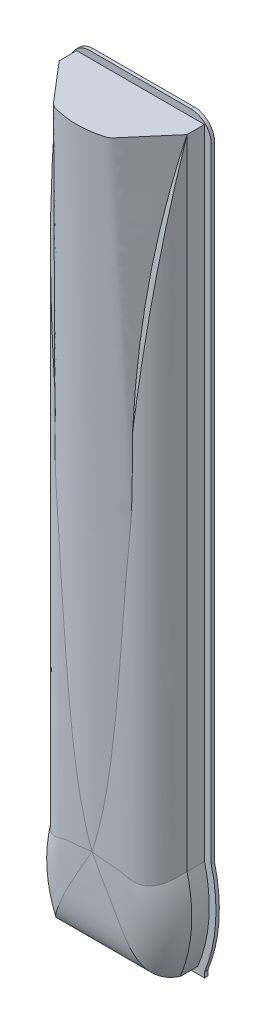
SolidWorks part; units mm, degrees
ref_plane "Ebene vorne" through (0, 0, 0) normal (0, 0, 1) x (1, 0, 0)
ref_plane "Ebene oben" through (0, 0, 0) normal (0, 1, 0) x (1, 0, 0)
ref_plane "Ebene rechts" through (0, 0, 0) normal (1, 0, 0) x (0, 0, -1)
sketch "Oben Master" plane through (0, 0, 0) normal (0, 0, 1) x (1, 0, 0)
  line L0 (0, 0) -> (0, 113.819) construction
  line L1 (7.4998, 109.3467) -> (-7.4998, 109.3467)
  line L2 (-9.5, 107.3446) -> (-9.5, 14.4995)
  line L3 (-8.5, 0.4995) -> (-8.5, 0.4995)
  line L4 (-8.5, 0.4995) -> (-3.5, 0.4995)
  line L5 (-3.5, 0.4995) -> (-3.5, 1)
  line L6 (-3.5, 1) -> (3.5, 1)
  line L7 (3.5, 1) -> (3.5, 0.4995)
  line L8 (3.5, 0.4995) -> (8.5, 0.4995)
  line L9 (8.5, 0.4995) -> (8.5, 0.4995)
  line L10 (9.5, 14.4995) -> (9.5, 107.3446)
  line L20 (2.5, 0) -> (2.5, -0.5005)
  line L21 (2.5, -0.5005) -> (9.5, -0.5005)
  line L22 (9.5, -0.5005) -> (9.5, 0.3012)
  line L23 (10.5, 14.6254) -> (10.5, 107.3448)
  line L24 (7.5, 110.3467) -> (-7.5, 110.3467)
  line L25 (-10.5, 107.3448) -> (-10.5, 14.6254)
  line L26 (-9.5, 0.3012) -> (-9.5, -0.5005)
  line L27 (-9.5, -0.5005) -> (-2.5, -0.5005)
  line L28 (-2.5, -0.5005) -> (-2.5, 0)
  line L29 (-2.5, 0) -> (2.5, 0)
  arc A0 (-9.5, 14.4995) -> (-8.5, 0.4995) centre (11.7977, 8.9851) ccw
  arc A1 (8.5, 0.4995) -> (9.5, 14.4995) centre (-11.7977, 8.9851) ccw
  arc A4 (9.5, 0.3012) -> (10.5, 14.6254) centre (-11.7977, 8.9851) ccw
  arc A5 (-10.5, 14.6254) -> (-9.5, 0.3012) centre (11.7977, 8.9851) ccw
  ellipse E1 centre (-9.5, 104.4132) end of major axis (-9.5, 105.4141) minor radius 1 (-10.5, 104.4132) -> (-9.5, 103.4122) ccw
  ellipse E3 centre (-9.5, 104.4132) end of major axis (-9.5, 105.4141) minor radius 1 (-9.5, 105.4141) -> (-10.5, 104.4132) ccw
  ellipse E5 centre (-9.5, 95.3481) end of major axis (-9.5, 96.3491) minor radius 1 (-9.5, 96.3491) -> (-10.5, 95.3481) ccw
  ellipse E7 centre (-9.5, 95.3481) end of major axis (-9.5, 96.3491) minor radius 1 (-10.5, 95.3481) -> (-9.5, 94.3471) ccw
  ellipse E9 centre (-9.5, 88.4775) end of major axis (-9.5, 87.4765) minor radius 1 (-9.5, 89.4785) -> (-10.5, 88.4775) ccw
  ellipse E11 centre (-9.5, 88.4775) end of major axis (-9.5, 87.4765) minor radius 1 (-10.5, 88.4775) -> (-9.5, 87.4765) ccw
  ellipse E13 centre (-9.5, 79.4124) end of major axis (-9.5, 78.4114) minor radius 1 (-9.5, 80.4134) -> (-10.5, 79.4124) ccw
  ellipse E15 centre (-9.5, 79.4124) end of major axis (-9.5, 80.4134) minor radius 1 (-10.5, 79.4124) -> (-9.5, 78.4114) ccw
  ellipse E17 centre (-9.5, 72.5418) end of major axis (-9.5, 71.5408) minor radius 1 (-9.5, 73.5428) -> (-10.5, 72.5418) ccw
  ellipse E19 centre (-9.5, 72.5418) end of major axis (-9.5, 71.5408) minor radius 1 (-10.5, 72.5418) -> (-9.5, 71.5408) ccw
  ellipse E21 centre (-9.5, 63.4767) end of major axis (-9.5, 62.4758) minor radius 1 (-9.5, 64.4777) -> (-10.5, 63.4767) ccw
  ellipse E23 centre (-9.5, 63.4767) end of major axis (-9.5, 64.4777) minor radius 1 (-10.5, 63.4767) -> (-9.5, 62.4758) ccw
  ellipse E25 centre (-9.5, 56.6061) end of major axis (-9.5, 55.6051) minor radius 1 (-9.5, 57.6071) -> (-10.5, 56.6061) ccw
  ellipse E27 centre (-9.5, 56.6061) end of major axis (-9.5, 57.6071) minor radius 1 (-10.5, 56.6061) -> (-9.5, 55.6051) ccw
  ellipse E29 centre (-9.5, 47.5411) end of major axis (-9.5, 46.5401) minor radius 1 (-9.5, 48.542) -> (-10.5, 47.5411) ccw
  ellipse E31 centre (-9.5, 47.5411) end of major axis (-9.5, 48.542) minor radius 1 (-10.5, 47.5411) -> (-9.5, 46.5401) ccw
  ellipse E33 centre (-9.5, 40.6705) end of major axis (-9.5, 39.6695) minor radius 1 (-9.5, 41.6714) -> (-10.5, 40.6705) ccw
  ellipse E35 centre (-9.5, 40.6705) end of major axis (-9.5, 39.6695) minor radius 1 (-10.5, 40.6705) -> (-9.5, 39.6695) ccw
  ellipse E37 centre (-9.5, 31.6054) end of major axis (-9.5, 32.6064) minor radius 1 (-10.5, 31.6054) -> (-9.5, 30.6044) ccw
  ellipse E39 centre (-9.5, 31.6054) end of major axis (-9.5, 30.6044) minor radius 1 (-9.5, 32.6064) -> (-10.5, 31.6054) ccw
  ellipse E41 centre (-9.5, 24.7348) end of major axis (-9.5, 25.7358) minor radius 1 (-9.5, 25.7358) -> (-10.5, 24.7348) ccw
  ellipse E43 centre (-9.5, 24.7348) end of major axis (-9.5, 25.7358) minor radius 1 (-10.5, 24.7348) -> (-9.5, 23.7338) ccw
  ellipse E45 centre (-9.5, 15.6697) end of major axis (-9.5, 16.6707) minor radius 1 (-9.5, 16.6707) -> (-10.5, 15.6697) ccw
  ellipse E47 centre (-9.5, 15.6697) end of major axis (-9.5, 16.6707) minor radius 1 (-10.5, 15.6697) -> (-9.5, 14.6687) ccw
  ellipse E49 centre (-10.1882, 9.8177) end of major axis (-10.1882, 10.8187) minor radius 1 (-10.1295, 10.817) -> (-11.1875, 9.8537) ccw
  ellipse E51 centre (-10.1882, 9.8177) end of major axis (-9.1882, 9.8177) minor radius 0.999 (-11.1882, 9.8177) -> (-10.2013, 8.8188) ccw
  ellipse E53 centre (-9.7425, 4.5537) end of major axis (-9.7425, 3.5528) minor radius 1 (-9.9237, 5.5382) -> (-10.7425, 4.5537) ccw
  ellipse E55 centre (-9.7425, 4.5537) end of major axis (-8.7425, 4.5537) minor radius 0.999 (-10.7425, 4.5537) -> (-9.5167, 3.5805) ccw
  ellipse E57 centre (-5.6, 109.39) end of major axis (-5.6, 108.3891) minor radius 1 (-5.6443, 110.39) -> (-6.6, 109.39) ccw
  ellipse E59 centre (-5.6, 109.39) end of major axis (-5.6, 108.3891) minor radius 1 (-4.6, 109.39) -> (-5.5557, 110.39) ccw
  ellipse E61 centre (0, 109.39) end of major axis (0, 108.3891) minor radius 1 (-0.0443, 110.39) -> (-1, 109.39) ccw
  ellipse E63 centre (0, 109.39) end of major axis (0, 108.3891) minor radius 1 (1, 109.39) -> (0.0443, 110.39) ccw
  ellipse E65 centre (5.6, 109.39) end of major axis (5.6, 110.391) minor radius 1 (6.6, 109.39) -> (5.6443, 110.39) ccw
  ellipse E67 centre (5.6, 109.39) end of major axis (5.6, 110.391) minor radius 1 (5.5557, 110.39) -> (4.6, 109.39) ccw
  spline S0 degree 1 poles (-7.4998, 109.3467) (-9.5, 107.3446) knots 0 0 1 1 construction
  spline S1 degree 1 poles (9.5, 107.3446) (7.4998, 109.3467) knots 0 0 1 1 construction
  spline S2 degree 3 poles (-7.4998, 109.3467) (-8.01, 109.3465) (-9.0728, 108.9205) (-9.4998, 107.8555) (-9.5, 107.3446) knots 0.00005 0.00005 0.00005 0.00005 0.5 0.999949 0.999949 0.999949 0.999949
  spline S3 degree 3 poles (9.5, 107.3446) (9.4998, 107.8551) (9.0741, 108.9192) (8.0103, 109.3465) (7.4998, 109.3467) knots 0.00005 0.00005 0.00005 0.00005 0.499999 0.999949 0.999949 0.999949 0.999949
  spline S5 degree 2 poles (10.5, 107.3448) (10.4998, 107.9419) (10.2718, 108.4932) (10.044, 109.0439) (9.6224, 109.4664) (9.2017, 109.888) (8.6508, 110.1171) (8.0991, 110.3465) (7.5, 110.3467) knots 0 0 0 0.25 0.25 0.5 0.5 0.75 0.75 1 1 1
  spline S6 degree 2 poles (-7.5, 110.3467) (-8.0971, 110.3465) (-8.6484, 110.1181) (-9.1987, 109.89) (-9.6209, 109.4679) (-10.042, 109.0468) (-10.2708, 108.4957) (-10.4998, 107.9439) (-10.5, 107.3448) knots 0 0 0 0.25 0.25 0.5 0.5 0.75 0.75 1 1 1
  dimension "D1" = 1
ref_plane "Hinten" through (0, 110.3467, 0) normal (0, 1, 0) x (-1, 0, 0)
ref_plane "Vorn" through (0, -0.5005, 0) normal (0, 1, 0) x (-1, 0, 0)
ref_plane "Ebene3" through (0, 109.3467, 0) normal (0, 1, 0) x (-1, 0, 0)
sketch "Hinten eckig" plane through (0, 110.3467, 0) normal (0, 1, 0) x (-1, 0, 0)
  line B0 (3.9658, 9.3399) -> (4.2597, 9.5705)
  line B1 (4.1712, 9.1409) -> (3.9658, 9.3399)
  line B2 (-0.8535, 3.2331) -> (-0.835, 0.4969)
  line B3 (0.7828, 0.5219) -> (0.7642, 3.2582)
  line B4 (0.7951, -1.8098) -> (0.7828, 0.5219)
  line B5 (5.9708, 0.4833) -> (5.9523, 3.2195)
  line B6 (4.3878, 0.5182) -> (0.7828, 0.5219)
  line B7 (0.7795, -0.0373) -> (4.3846, -0.0409)
  line B8 (-0.835, 0.4969) -> (-4.44, 0.5006)
  line B9 (-4.4086, 0.0014) -> (-0.8034, -0.0023)
  line B10 (-3.9584, 9.3601) -> (-4.2239, 9.5939)
  line B11 (-9.3309, 1.3292) -> (-9.3343, 0.7699)
  line B12 (-4.1575, 9.1548) -> (-3.9584, 9.3601)
  line B13 (-6.023, 0.5356) -> (-8.0452, 0.5043)
  line B14 (0.0262, 12.5033) -> (-1.2819, 12.4592)
  line B15 (-1.2819, 12.4592) -> (-2.6595, 12.2951)
  line B16 (4.0007, 9.3998) -> (3.691, 9.419)
  line B17 (0.149, 9.9471) -> (-0.1006, 9.9314)
  line B18 (-1.753, 9.8463) -> (-2.0974, 9.8053)
  line B19 (-3.6741, 9.4359) -> (-3.9584, 9.3601)
  line B20 (-8.9516, 2.9531) -> (-9.1696, 2.4381)
  line B21 (-9.1696, 2.4381) -> (-9.2676, 1.8537)
  line B22 (-9.0369, 3.0826) -> (-9.255, 2.5678)
  line B23 (-9.255, 2.5678) -> (-9.413, 2.0179)
  line B24 (-8.7523, 4.6814) -> (-9.3085, 3.721)
  line B25 (-8.7933, 5.0258) -> (-9.3148, 4.1254)
  line B26 (-8.7395, 5.3955) -> (-9.2958, 4.435)
  line B27 (10.7962, 4.6627) -> (11.1754, 4.7637)
  line B28 (-10.4073, 0) -> (10.4073, 0)
sketch_block_instance "Block4-1"
sketch_block "Block4"
sketch "Vorn rund" plane through (0, -0.5005, 0) normal (0, 1, 0) x (-1, 0, 0)
  line L0 (2.5, 0) -> (-2.5, 0) construction
  line L1 (2.5, 0) -> (-2.5, 0)
  line L2 (0, 0) -> (0, -4.3632) construction
  line B0 (-11.3923, 1.0416) -> (-11.3496, 0.1382)
  line B1 (-10.6355, 0.1293) -> (-10.6008, 0.7487)
  line B2 (8.4284, -5.6606) -> (-8.4783, -5.7396)
  line B3 (-3.0393, -2.3777) -> (-3.0296, 0.0141)
  line B4 (7.4782, 5.6712) -> (5.4825, 6.6529)
  line B5 (5.4825, 6.6529) -> (4.476, 6.9889)
  line B6 (1.0949, 7.6442) -> (-0.0494, 7.7393)
  line B7 (-0.0494, 7.7393) -> (-1.297, 7.6537)
  line B8 (-1.297, 7.6537) -> (-2.6737, 7.4823)
  line B9 (-7.8197, 5.4712) -> (-8.405, 5.0068)
  line B10 (-8.405, 5.0068) -> (-8.8956, 4.5682)
  line B11 (-9.4207, 4.0694) -> (-9.7909, 3.5619)
  line B12 (-7.0407, -3.9247) -> (-6.3008, -4.0283)
  line B13 (-6.3008, -4.0283) -> (-5.8878, -3.865)
  line B14 (-6.5833, -0.7501) -> (-7.0566, -0.8789)
  line B15 (-10.9797, 0.0864) -> (-11.0744, 0.0606)
  line B16 (-11.0744, 0.0606) -> (-11.1345, 0.095)
  line B17 (-11.1345, 0.095) -> (-11.2292, 0.0693)
  line B18 (-11.2292, 0.0693) -> (-11.3496, 0.1382)
  line B19 (-9.9645, -0.0947) -> (-10.6529, -0.1805)
  line B20 (-10.9626, -0.1631) -> (-11.3154, -0.3608)
sketch_block_instance "Block5-1"
sketch_block "Block5"
sketch "Skizze7" plane through (0, 0, 0) normal (0, 0, 1) x (1, 0, 0)
  line L0 (11.7977, 8.9851) -> (-11.7977, 8.9851) construction
  line L10 (-2.5, -0.5005) -> (-2.5, 0)
  line L11 (-9.5, -0.5005) -> (-2.5, -0.5005)
  line L12 (-9.5, 0.3012) -> (-9.5, -0.5005)
  line L13 (-10.5, 107.3448) -> (-10.5, 14.6254)
  line L14 (7.5, 110.3467) -> (-7.5, 110.3467)
  line L15 (10.5, 14.6254) -> (10.5, 107.3448)
  line L16 (9.5, -0.5005) -> (9.5, 0.3012)
  line L17 (2.5, -0.5005) -> (9.5, -0.5005)
  line L18 (2.5, 0) -> (2.5, -0.5005)
  line L19 (-2.5, 0) -> (2.5, 0)
  line L20 (-2.5, -0.5005) -> (-2.5, 0)
  line L21 (-9.5, -0.5005) -> (-2.5, -0.5005)
  line L22 (-9.5, 0.3012) -> (-9.5, -0.5005)
  line L23 (-10.5, 107.3448) -> (-10.5, 14.6254)
  line L24 (7.5, 110.3467) -> (-7.5, 110.3467)
  line L25 (10.5, 14.6254) -> (10.5, 107.3448)
  line L26 (9.5, -0.5005) -> (9.5, 0.3012)
  line L27 (2.5, -0.5005) -> (9.5, -0.5005)
  line L28 (2.5, 0) -> (2.5, -0.5005)
  line L29 (-2.5, 0) -> (2.5, 0)
  arc A2 (-10.5, 14.6254) -> (-9.5, 0.3012) centre (11.7977, 8.9851) ccw
  arc A3 (9.5, 0.3012) -> (10.5, 14.6254) centre (-11.7977, 8.9851) ccw
  arc A4 (-10.5, 14.6254) -> (-9.5, 0.3012) centre (11.7977, 8.9851) ccw
  arc A5 (9.5, 0.3012) -> (10.5, 14.6254) centre (-11.7977, 8.9851) ccw
  spline S2 degree 2 poles (713.2699, -2800.8964) (54.1611, 136.1464) (-8.6484, 110.1181) (-9.1987, 109.89) (-9.6209, 109.4679) (-10.042, 109.0468) (-10.2708, 108.4957) (-36.3165, 45.7429) (2896.8308, -629.2597) knots -28.236731 -28.236731 -28.236731 0.25 0.25 0.5 0.5 0.75 0.75 29.181014 29.181014 29.181014 only from (-7.5, 110.3467) to (-10.5, 107.3448)
  spline S3 degree 2 poles (-2900.6155, -613.9447) (36.2756, 45.6192) (10.2718, 108.4932) (10.044, 109.0439) (9.6224, 109.4664) (9.2017, 109.888) (8.6508, 110.1171) (-54.0371, 136.1872) (-728.5512, -2797.0685) knots -28.261947 -28.261947 -28.261947 0.25 0.25 0.5 0.5 0.75 0.75 29.155742 29.155742 29.155742 only from (10.5, 107.3448) to (7.5, 110.3467)
  spline S4 degree 2 poles (-7.5, 110.3467) (-8.0971, 110.3465) (-8.6484, 110.1181) (-9.1987, 109.89) (-9.6209, 109.4679) (-10.042, 109.0468) (-10.2708, 108.4957) (-10.4998, 107.9439) (-10.5, 107.3448) knots 0 0 0 0.25 0.25 0.5 0.5 0.75 0.75 1 1 1
  spline S5 degree 2 poles (10.5, 107.3448) (10.4998, 107.9419) (10.2718, 108.4932) (10.044, 109.0439) (9.6224, 109.4664) (9.2017, 109.888) (8.6508, 110.1171) (8.0991, 110.3465) (7.5, 110.3467) knots 0 0 0 0.25 0.25 0.5 0.5 0.75 0.75 1 1 1
  dimension "D1" = 0
extrude "Linear austragen1" add sketch "Skizze7" along normal blind 0.5
sketch "Skizze20" plane through (0, 0, 0.5) normal (0, 0, 1) x (1, 0, 0)
  line L20 (-8.5, 0.4995) -> (-3.5, 0.4995)
  line L21 (-3.5, 0.4995) -> (-3.5, 1)
  line L22 (-3.5, 1) -> (3.5, 1)
  line L23 (3.5, 1) -> (3.5, 0.4995)
  line L24 (3.5, 0.4995) -> (8.5, 0.4995)
  line L25 (9.5, 14.4995) -> (9.5, 107.3444)
  line L26 (7.5, 109.3467) -> (-7.4996, 109.3467)
  line L27 (-9.5, 107.3448) -> (-9.5, 14.4995)
  line L28 (-8.5, 0.4995) -> (8.5, 0.4995)
  line L33 (9.5, 14.4995) -> (9.5, 109.3467)
  line L34 (9.5, 109.3467) -> (-9.5, 109.3467)
  line L35 (-9.5, 109.3467) -> (-9.5, 14.4995)
  arc A4 (8.5, 0.4995) -> (9.5, 14.4995) centre (-11.7977, 8.9851) ccw
  arc A5 (-9.5, 14.4995) -> (-8.5, 0.4995) centre (11.7977, 8.9851) ccw
  arc A6 (8.5, 0.4995) -> (9.5, 14.4995) centre (-11.7977, 8.9851) ccw
  arc A7 (-9.5, 14.4995) -> (-8.5, 0.4995) centre (11.7977, 8.9851) ccw
  spline S4 degree 3 poles (3964.4855, 699.077) (-562.275, -46.0003) (14.8299, 80.6068) (9.4371, 107.8617) (9.3983, 107.9884) (9.2983, 108.2308) (9.2375, 108.346) (9.0928, 108.5635) (9.008, 108.6662) (8.8237, 108.8513) (8.7234, 108.9347) (8.5051, 109.0812) (8.3882, 109.1432) (-5.6702, 114.9984) (-93.3907, -37.5243) (3687.0661, -1447.9628) knots -26.430749 -26.430749 -26.430749 -26.430749 0.125 0.125 0.25 0.25 0.375 0.375 0.5 0.5 0.625 0.625 0.75 0.75 15.225421 15.225421 15.225421 15.225421 only from (9.5, 107.3444) to (7.5, 109.3467)
  spline S5 degree 3 poles (-599.4917, 4064.2795) (145.9772, -463.2528) (19.2162, 114.6882) (-8.0169, 109.2836) (-8.1436, 109.2447) (-8.3858, 109.1445) (-8.501, 109.0836) (-8.7183, 108.9385) (-8.8209, 108.8536) (-9.0057, 108.669) (-9.0889, 108.5686) (-9.2352, 108.35) (-9.297, 108.2332) (-15.1452, 94.1505) (137.5454, 6.4943) (1533.7503, 3792.9331) knots -26.411857 -26.411857 -26.411857 -26.411857 0.125 0.125 0.25 0.25 0.375 0.375 0.5 0.5 0.625 0.625 0.75 0.75 15.244525 15.244525 15.244525 15.244525 only from (-7.4996, 109.3467) to (-9.5, 107.3448)
  spline S6 degree 3 poles (9.5, 107.3444) (9.5, 107.4764) (9.4876, 107.6063) (9.4371, 107.8617) (9.3983, 107.9884) (9.2983, 108.2308) (9.2375, 108.346) (9.0928, 108.5635) (9.008, 108.6662) (8.8237, 108.8513) (8.7234, 108.9347) (8.5051, 109.0812) (8.3882, 109.1432) (8.0272, 109.2936) (7.7644, 109.3466) (7.5, 109.3467) knots 0 0 0 0 0.125 0.125 0.25 0.25 0.375 0.375 0.5 0.5 0.625 0.625 0.75 0.75 1 1 1 1 construction
  spline S7 degree 3 poles (-7.4996, 109.3467) (-7.6316, 109.3467) (-7.7615, 109.3343) (-8.0169, 109.2836) (-8.1436, 109.2447) (-8.3858, 109.1445) (-8.501, 109.0836) (-8.7183, 108.9385) (-8.8209, 108.8536) (-9.0057, 108.669) (-9.0889, 108.5686) (-9.2352, 108.35) (-9.297, 108.2332) (-9.447, 107.8719) (-9.4999, 107.6092) (-9.5, 107.3448) knots 0 0 0 0 0.125 0.125 0.25 0.25 0.375 0.375 0.5 0.5 0.625 0.625 0.75 0.75 1 1 1 1 construction
  dimension "D1" = 1
extrude "Linear austragen7" add sketch "Skizze20" along normal blind 2.6
sketch "Skizze6" plane through (0, -0.5005, 0) normal (0, 1, 0) x (-1, 0, 0)
  line L0 (0, -6.8266) -> (0, 9.0288) construction
  line L1 (-0.0494, 7.7393) -> (-7.8197, 5.4712) construction
  line L2 (-3.9345, 6.6052) -> (-0.0138, -6.8266) construction
  line L3 (-2.5892, 1.9964) -> (-2.6957, 2.3611) construction
  line L4 (0.5228, 7.6917) -> (6.7967, 6.0065) construction
  line L5 (1.0949, 7.6442) -> (-0.0494, 7.7393) construction
  line L6 (7.4782, 5.6712) -> (5.4825, 6.6529) construction
  line L7 (3.6597, 6.8491) -> (-0.0138, -6.8266) construction
  line L8 (-1.4467, -8.0426) -> (2.1223, -8.0426) construction
  line L9 (-0.0138, -6.8266) -> (0.0485, -6.8266) construction
  line L10 (-10.6252, 0.3118) -> (-9.7909, 3.5619) construction
  line L11 (-10.6355, 0.1293) -> (-10.6008, 0.7487) construction
  line L12 (-9.7909, 3.5619) -> (-10.208, 1.9368) construction
  line L13 (-10.208, 1.9368) -> (-1.9532, -0.1823) construction
  line L14 (-9.7909, 3.5619) -> (-8.405, 5.0068) construction
  line L15 (-9.0979, 4.2844) -> (-5.3503, 0.6897) construction
  line L16 (-8.4323, 5.0196) -> (0, -6.8266) construction
  line L17 (8.4323, 5.0196) -> (0, -6.8266) construction
  line L18 (0, 0) -> (-13.7892, 0) construction
  line L20 (-9.5, 0.5) -> (-11.2023, 0.5) construction
  line L21 (9.0979, 4.2844) -> (5.3503, 0.6897) construction
  line L22 (10.6617, 0.5) -> (-10.6617, 0.5)
  line L23 (9.7909, 3.5619) -> (8.405, 5.0068) construction
  line L24 (9.7909, 3.5619) -> (10.208, 1.9368) construction
  line L25 (10.6252, 0.3118) -> (9.7909, 3.5619) construction
  arc A0 (8.4323, 5.0196) -> (-8.4323, 5.0196) centre (0, -6.8266) ccw
  arc A1 (-8.4323, 5.0196) -> (-10.6617, 0.5) centre (-5.3503, 0.6897) ccw
  arc A2 (8.4323, 5.0196) -> (10.6617, 0.5) centre (5.3503, 0.6897) cw
sketch "Skizze8" plane through (0, 109.3467, 0) normal (0, 1, 0) x (-1, 0, 0)
  line L0 (-3.965, 9.35) -> (3.965, 9.35) construction
  line L1 (9.5, 0.5) -> (9.5, 2.3569)
  line L2 (0, 0) -> (3.965, 9.35) construction
  line L3 (0, 0) -> (0, 15.3071) construction
  line L4 (0, 0) -> (-3.965, 9.35) construction
  line L5 (-4.543, 8.8909) -> (-9.0199, 3.6569)
  line L6 (-9.5, 0.5) -> (-9.5, 2.3569)
  line L8 (-7.5, 0.5) -> (7.5, 0.5) construction
  line L9 (4.543, 8.8909) -> (9.0199, 3.6569)
  line L10 (-10.5, 0.5) -> (-10.5, 0) construction
  line L11 (10.5, 0.5) -> (10.5, 0) construction
  line L12 (-9.5, 0.5) -> (9.5, 0.5)
  arc A0 (-3.5526, 9.5195) -> (3.5526, 9.5195) centre (0, -3.4217) cw
  arc A1 (-3.5526, 9.5195) -> (-4.543, 8.8909) centre (-3.0232, 7.5909) ccw
  arc A2 (4.543, 8.8909) -> (3.5526, 9.5195) centre (3.0232, 7.5909) ccw
  arc A3 (-9.5, 2.3569) -> (-9.0199, 3.6569) centre (-7.5, 2.3569) cw
  arc A4 (9.5, 2.3569) -> (9.0199, 3.6569) centre (7.5, 2.3569) ccw
  dimension "D3" = 1
  dimension "D1" = 2
  dimension "D2" = 9.35
  dimension "D4" = 1
ref_plane "Ebene1" through (0, 8.9851, 0) normal (0, 1, 0) x (-1, 0, 0)
sketch "Skizze10" plane through (0, 8.9851, 0) normal (0, 1, 0) x (-1, 0, 0)
  line L0 (0, 0) -> (0, 9.7413) construction
  line L1 (-10.6617, 0.5) -> (10.6617, 0.5)
  line L2 (8.5, 3.1) -> (-8.5, 3.1) construction
  line L3 (-11.2023, 0.5) -> (-10.2023, 0.5) construction
  line L4 (-7.5, 0.5) -> (-10.5, 0.5) construction
  line L5 (10.2023, 3.1) -> (-10.2023, 3.1)
  line L6 (-8.5, 3.1) -> (-10.2023, 3.1) construction
  arc A0 (-10.2023, 3.1) -> (-8.673, 4.8446) centre (-5.3844, 0.4192) cw
  arc A1 (10.2023, 3.1) -> (8.673, 4.8446) centre (5.3844, 0.4192) ccw
  arc A3 (10.6617, 0.5) -> (8.4323, 5.0196) centre (5.3503, 0.6897) ccw
  arc A4 (8.4323, 5.0196) -> (-8.4323, 5.0196) centre (0, -6.8266) ccw
  arc A5 (-8.4323, 5.0196) -> (-10.6617, 0.5) centre (-5.3503, 0.6897) ccw
  arc A7 (8.673, 4.8446) -> (-8.673, 4.8446) centre (0, -6.8266) ccw
  dimension "D2" = 1
  dimension "D1" = 0
ref_plane "Ebene2" through (0, 14.6254, 0) normal (0, 1, 0) x (-1, 0, 0)
sketch "Formgeber Mitte" plane through (0, 14.6254, 0) normal (0, 1, 0) x (-1, 0, 0)
  line L0 (0, -6.822) -> (0, 15.3071) construction
  line L1 (-9.5, 3.1) -> (9.5, 3.1) construction
  line L5 (-9.5, 3.1) -> (9.5, 3.1)
  line L10 (0, 0) -> (0, -2.1163) construction
  line L11 (-9.5, 3.1) -> (-7.2869, 5.6874)
  line L12 (-4.543, 8.8909) -> (-9.0199, 3.6569) construction
  line L13 (9.5, 3.1) -> (7.2869, 5.6874)
  arc A5 (8.673, 4.8446) -> (-8.673, 4.8446) centre (0, -6.8266) ccw construction
  arc A6 (7.0089, 5.9136) -> (-7.0089, 5.9136) centre (0, -6.8266) ccw
  arc A9 (-7.2869, 5.6874) -> (-7.0089, 5.9136) centre (-6.5269, 5.0374) cw
  arc A10 (7.2869, 5.6874) -> (7.0089, 5.9136) centre (6.5269, 5.0374) ccw
  point P11 (-7.1707, 5.8233)
  point P18 (7.1707, 5.8233)
  dimension "D1" = 1
sketch "Formgeber hinten" plane through (0, 109.3467, 0) normal (0, 1, 0) x (1, 0, 0)
  line L0 (4.543, -8.8909) -> (9.0199, -3.6569) construction
  line L1 (4.543, -8.8909) -> (9.4962, -3.1)
  line L2 (-4.543, -8.8909) -> (-9.0199, -3.6569) construction
  line L3 (-4.543, -8.8909) -> (-9.4962, -3.1)
  line L4 (9.5, -3.1) -> (-9.5, -3.1) construction
  line L5 (9.4962, -3.1) -> (-9.4962, -3.1)
  arc A0 (3.5526, -9.5195) -> (4.543, -8.8909) centre (3.0232, -7.5909) ccw construction
  arc A1 (3.5526, -9.5195) -> (4.543, -8.8909) centre (3.0232, -7.5909) ccw
  arc A2 (-3.5526, -9.5195) -> (3.5526, -9.5195) centre (0, 3.4217) ccw construction
  arc A3 (-3.5526, -9.5195) -> (3.5526, -9.5195) centre (0, 3.4217) ccw
  arc A4 (-4.543, -8.8909) -> (-3.5526, -9.5195) centre (-3.0232, -7.5909) ccw construction
  arc A5 (-4.543, -8.8909) -> (-3.5526, -9.5195) centre (-3.0232, -7.5909) ccw
sketch "Rücken" plane through (0, 0, 0) normal (1, 0, 0) x (0, 0, -1)
  line L0 (-9.5195, 109.3467) -> (-9.9983, 109.3467) construction
  line L1 (-9.5195, 109.3467) -> (-9.9983, 109.3467) construction
  line L3 (-3.1, 0.4995) -> (-0.5, 0.4995) construction
  line L4 (-4.8446, 8.9851) -> (-7.7143, 8.9851) construction
  line L5 (-4.8446, 8.9851) -> (-7.7143, 8.9851) construction
  line L6 (-3.1, 0.4995) -> (-0.5, 0.4995) construction
  line L7 (-7.7143, 8.9851) -> (-9.9983, 109.3467)
  spline S0 degree 3 poles (-7.7143, 8.9851) (-7.6435, 5.8735) (-7.8099, 0.9279) (-3.1, 0.4995) knots 0 0 0 0 1 1 1 1
sketch "Pkt vorn" plane through (0, 14.6254, 0) normal (0, 1, 0) x (-1, 0, 0)
  arc A0 (7.0089, 5.9136) -> (-7.0089, 5.9136) centre (0, -6.8266) ccw construction
  arc A1 (7.0089, 5.9136) -> (-7.0089, 5.9136) centre (0, -6.8266) ccw construction
  point P3 (0, 7.7143)
sketch "Pkt hinten" plane through (0, 109.3467, 0) normal (0, 1, 0) x (-1, 0, 0)
  arc A0 (3.5526, 9.5195) -> (-3.5526, 9.5195) centre (0, -3.4217) ccw construction
  arc A1 (3.5526, 9.5195) -> (-3.5526, 9.5195) centre (0, -3.4217) ccw construction
  point P3 (0, 9.9983)
sketch "Leitlinie links" plane through (0, 0, 3.1) normal (0, 0, 1) x (1, 0, 0)
  line L0 (9.5, 14.4995) -> (9.5, 109.3467) construction
  line L1 (9.5, 14.4995) -> (9.5, 109.3467)
  arc A0 (8.5, 0.4995) -> (9.5, 14.4995) centre (-11.7977, 8.9851) ccw construction
  arc A1 (8.5, 0.4995) -> (9.5, 14.4995) centre (-11.7977, 8.9851) ccw
sketch "Leitline rechts" plane through (0, 0, 3.1) normal (0, 0, 1) x (1, 0, 0)
  line L0 (-9.5, 109.3467) -> (-9.5, 14.4995) construction
  line L1 (-9.5, 109.3467) -> (-9.5, 14.4995)
  arc A0 (-9.5, 14.4995) -> (-8.5, 0.4995) centre (11.7977, 8.9851) ccw construction
  arc A1 (-9.5, 14.4995) -> (-8.5, 0.4995) centre (11.7977, 8.9851) ccw
sketch "Gerader Abschluß" plane through (0, 0.4995, 0) normal (0, -1, 0) x (1, 0, 0)
  line L0 (-8.5, 3.1) -> (8.5, 3.1) construction
  line L1 (-8.5, 3.1) -> (8.5, 3.1)
sketch "Skizze31" plane through (0, 0, 3.1) normal (0, 0, 1) x (1, 0, 0)
  line L4 (-8.5, 0.4995) -> (8.5, 0.4995)
  line L5 (-9.5, 109.3467) -> (-9.5, 14.4995)
  line L6 (9.5, 109.3467) -> (-9.5, 109.3467)
  line L7 (9.5, 14.4995) -> (9.5, 109.3467)
  line L8 (-8.5, 0.4995) -> (8.5, 0.4995)
  line L9 (-9.5, 109.3467) -> (-9.5, 14.4995)
  line L10 (9.5, 109.3467) -> (-9.5, 109.3467)
  line L11 (9.5, 14.4995) -> (9.5, 109.3467)
  arc A2 (-9.5, 14.4995) -> (-8.5, 0.4995) centre (11.7977, 8.9851) ccw
  arc A3 (8.5, 0.4995) -> (9.5, 14.4995) centre (-11.7977, 8.9851) ccw
  arc A4 (-9.5, 14.4995) -> (-8.5, 0.4995) centre (11.7977, 8.9851) ccw
  arc A5 (8.5, 0.4995) -> (9.5, 14.4995) centre (-11.7977, 8.9851) ccw
  dimension "D1" = 0
sketch "Skizze32" plane through (0, 0, 0) normal (1, 0, 0) x (0, 0, -1)
  line L0 (-7.7143, 8.9851) -> (-9.9983, 109.3467) construction
  line L1 (-7.8427, 14.6254) -> (-9.9983, 109.3467)
sketch "Skizze33" plane through (0, 0, 0) normal (1, 0, 0) x (0, 0, -1)
  line L0 (-7.7143, 8.9851) -> (-9.9983, 109.3467) construction
  line L1 (-7.7143, 8.9851) -> (-7.8427, 14.6254)
  spline S0 degree 3 poles (-1205.4427, -1592.6647) (1244.5026, 1647.3738) (-1318.4035, -1583.5758) (1365.8305, 1457.6872) knots -6.115897 -6.115897 -6.115897 -6.115897 6.496706 6.496706 6.496706 6.496706 only from (-7.7143, 8.9851) to (-3.1, 0.4995) construction
  spline S1 degree 3 poles (-7.7143, 8.9851) (-7.6435, 5.8735) (-7.8099, 0.9279) (-3.1, 0.4995) knots 0 0 0 0 1 1 1 1
loft "Ausformung5" add profiles "Skizze31", "Pkt vorn"
loft "Ausformung9" add profiles "Formgeber hinten", "Formgeber Mitte"
